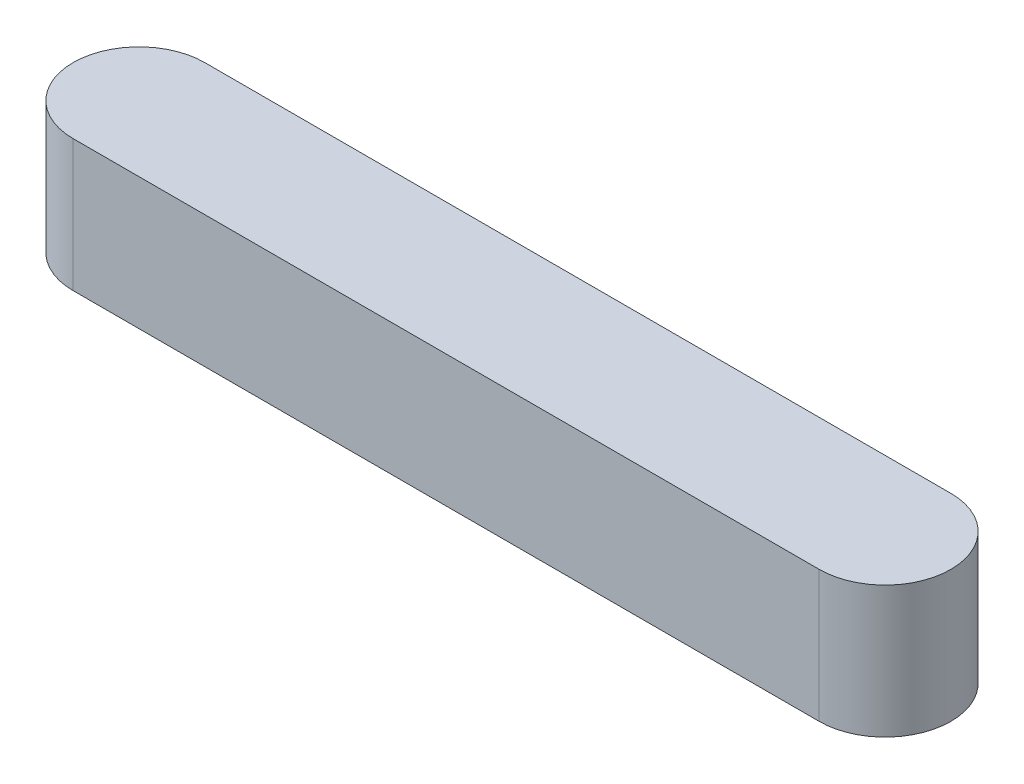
SolidWorks part; units mm, degrees
ref_plane "Face" through (0, 0, 0) normal (0, 0, 1) x (1, 0, 0)
ref_plane "Dessus" through (0, 0, 0) normal (0, 1, 0) x (1, 0, 0)
ref_plane "Droite" through (0, 0, 0) normal (1, 0, 0) x (0, 0, -1)
sketch "Esquisse1" plane through (0, 0, 0) normal (0, -1, 0) x (0, 0, -1)
  line L0 (3, 0) -> (3, -34)
  line L1 (-3, 0) -> (-3, -34)
  arc A0 (3, 0) -> (-3, 0) centre (0, 0) ccw
  arc A1 (-3, -34) -> (3, -34) centre (0, -34) ccw
  dimension "D1" = 3
  dimension "D2" = 34
extrude "Base-Extrusion" add sketch "Esquisse1" along normal blind 6
